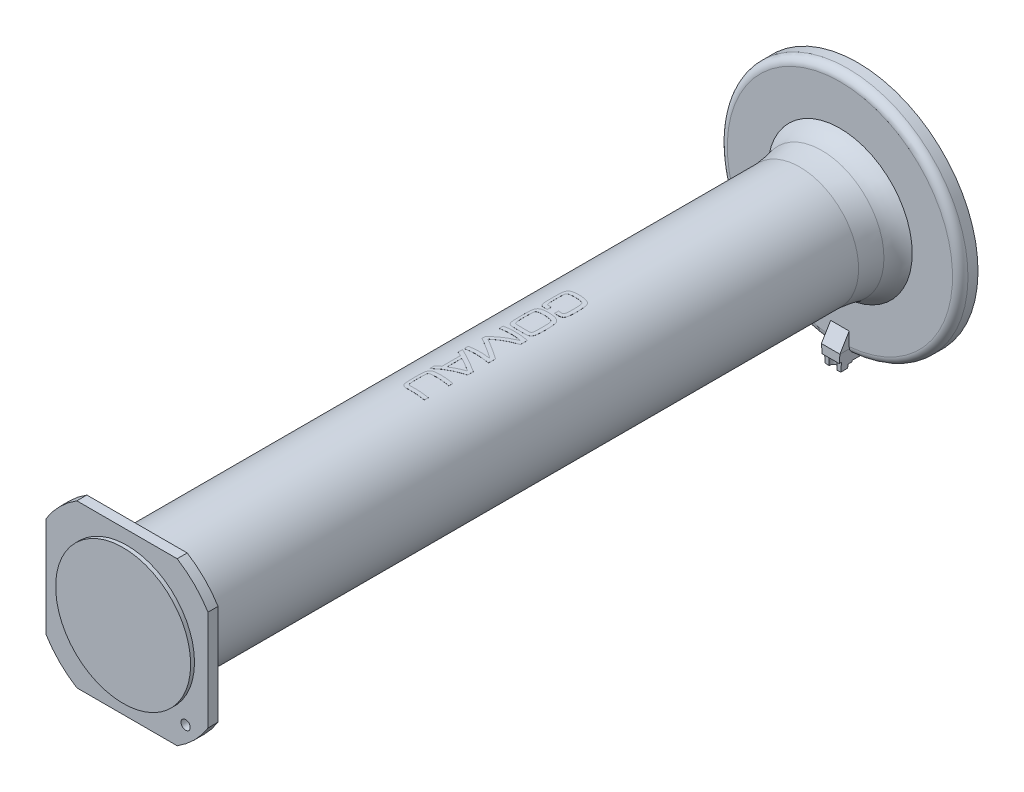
SolidWorks part; units mm, degrees
ref_plane "Piano1 (Front/Back)" through (0, 0, 0) normal (0, 0, 1) x (1, 0, 0)
ref_plane "Piano2 (Top/Bottom)" through (0, 0, 0) normal (0, 1, 0) x (1, 0, 0)
ref_plane "Piano3 (Left/Right)" through (0, 0, 0) normal (1, 0, 0) x (0, 0, -1)
imported_body "Importato1"
sketch "Schizzo1" plane through (0, 0, 0) normal (0, 1, 0) x (1, 0, 0)
  line L0 (-15, -580) -> (-15, -360) construction
  line L1 (156, 0) -> (-156, 0) construction
  line L2 (-87.5, -947.18) -> (87.5, -947.18) construction
  text T0 "COMAU" font "MicrogrammaDMedExt" height 31.5
  dimension "D1" = 15
  dimension "D2" = 220
  dimension "D3" = 580
  dimension "D4" = 587.18
extrude "Estrusione1" add sketch "Schizzo1" against normal offset from surface (75.5969 mm away) 0.1
sketch "Schizzo2" plane through (0, 0, 0) normal (0, 1, 0) x (1, 0, 0)
  line L0 (-15, -360) -> (-15, -580) construction
  text T0 "COMAU" font "MicrogrammaDMedExt" height 31.5
extrude "Estrusione2" add sketch "Schizzo2" along normal offset from surface (75.5969 mm away) 0.1
